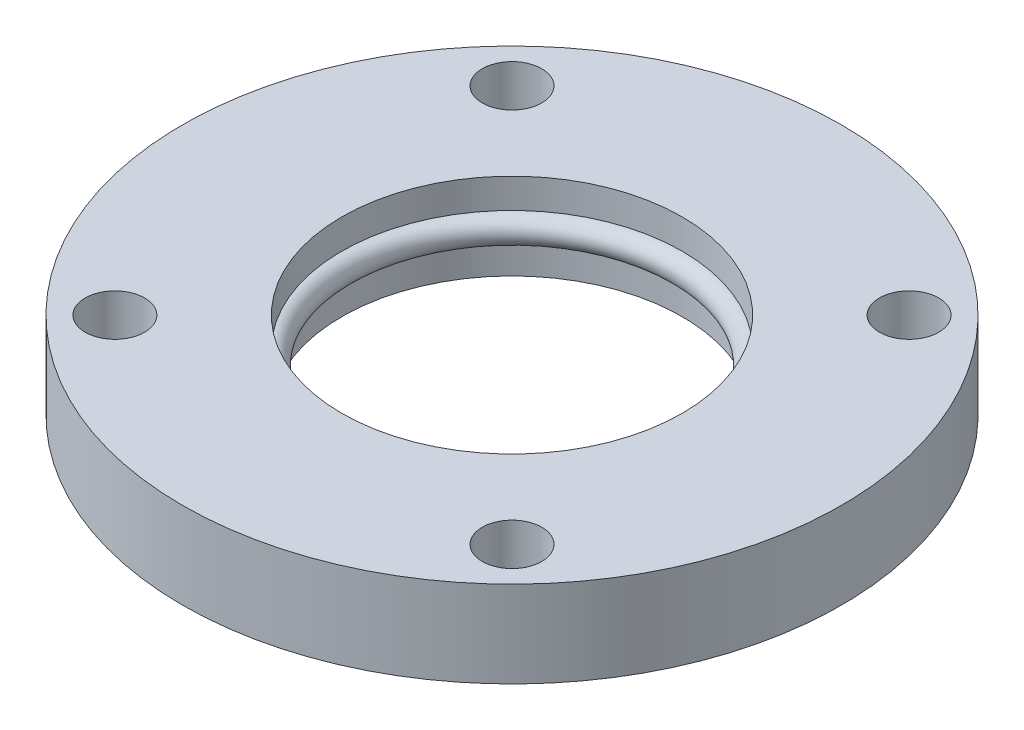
SolidWorks part; units mm, degrees
ref_plane "Front Plane" through (0, 0, 0) normal (0, 0, 1) x (1, 0, 0)
ref_plane "Top Plane" through (0, 0, 0) normal (0, 1, 0) x (1, 0, 0)
ref_plane "Right Plane" through (0, 0, 0) normal (1, 0, 0) x (0, 0, -1)
sketch "Sketch2" plane through (0, 0, 0) normal (0, 1, 0) x (1, 0, 0)
  line L1 (-36.75, -36.75) -> (36.75, -36.75) construction
  line L2 (-36.75, -36.75) -> (-36.75, 36.75) construction
  line L3 (-36.75, 36.75) -> (36.75, 36.75) construction
  line L4 (36.75, -36.75) -> (36.75, 36.75) construction
  line L5 (-36.75, -36.75) -> (36.75, 36.75) construction
  line L6 (-36.75, 36.75) -> (36.75, -36.75) construction
  circle A0 centre (0, 0) radius 31.5
  circle A1 centre (0, 0) radius 61
  circle A2 centre (-36.75, 36.75) radius 5.5
  circle A3 centre (36.75, 36.75) radius 5.5
  circle A4 centre (36.75, -36.75) radius 5.5
  circle A5 centre (-36.75, -36.75) radius 5.5
  dimension "D1" = 122
  dimension "D2" = 63
  dimension "D4" = 11
  dimension "D3" = 73.5
extrude "Boss-Extrude1" add sketch "Sketch2" along normal mid plane 16
sketch "Sketch3" plane through (0, 0, 0) normal (0, 0, 1) x (1, 0, 0)
  line L0 (-31.5, 0) -> (0, 0) construction
  line L1 (0, 0) -> (0, 8) construction
  line L2 (61, 8) -> (-61, 8) construction
  circle A0 centre (-31.5, 0) radius 2.5
  dimension "D1" = 5
  dimension "D2" = 63
revolve "Revolve2" add sketch "Sketch3" angle 360 about L1
